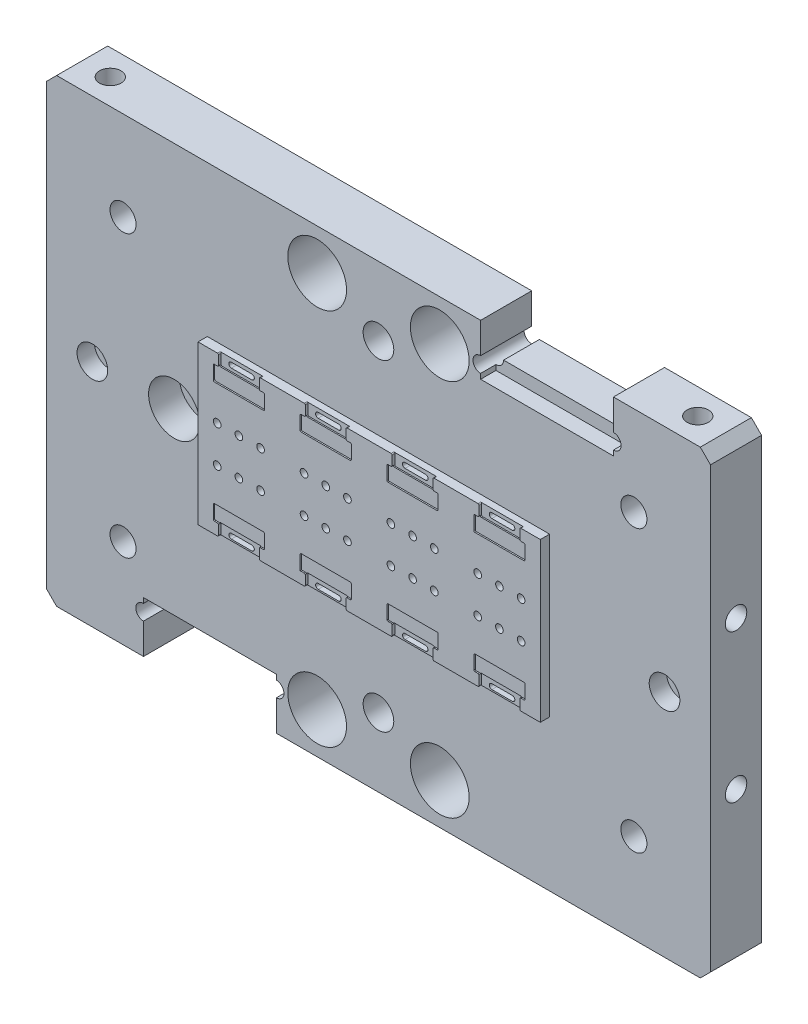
SolidWorks part; units mm, degrees
ref_plane "前视基准面" through (0, 0, 0) normal (0, 0, 1) x (1, 0, 0)
ref_plane "上视基准面" through (0, 0, 0) normal (0, 1, 0) x (1, 0, 0)
ref_plane "右视基准面" through (0, 0, 0) normal (1, 0, 0) x (0, 0, -1)
sketch "草图1" plane through (0, 0, 0) normal (0, 0, 1) x (1, 0, 0)
  line L1 (-65, 45) -> (65, 45)
  line L2 (-65, 45) -> (-65, -45)
  line L3 (-65, -45) -> (65, -45)
  line L4 (65, 45) -> (65, -45)
  line L5 (-65, 45) -> (65, -45) construction
  line L6 (-65, -45) -> (65, 45) construction
  point P0 (0, 0)
  dimension "D1" = 90
  dimension "D2" = 130
extrude "凸台-拉伸1" add sketch "草图1" along normal blind 10
chamfer "倒角1" distance 2 angle 45 4 edges at (-65, -45, 5) (65, -45, 5) (65, 45, 5) (-65, 45, 5)
hole_wizard "M3 六角圆柱头螺钉的柱形沉头孔1" positions "草图6" profile "草图7" counterbore size "M3" standard "GB"
sketch "草图6" plane through (0, 0, 10) normal (0, 0, 1) x (1, 0, 0)
  line L0 (0, 0) -> (-65, 0) construction
  line L1 (-65, 43) -> (-65, -43) construction
  line L4 (0, 0) -> (0, -45) construction
  line L5 (-63, -45) -> (63, -45) construction
  point P0 (-56, 0)
  point P2 (0, -31.5)
  point P24 (56, 0)
  point P25 (0, 31.5)
  dimension "D1" = 9
  dimension "D2" = 13.5
sketch "草图7" plane through (-56, 0, 10) normal (1, 0, 0) x (0, -1, 0)
  line L0 (0, 0) -> (0, 10)
  line L1 (0, 10) -> (1.7, 10)
  line L3 (1.7, 10) -> (1.7, 3.4)
  line L4 (1.7, 3.4) -> (3, 3.4)
  line L5 (3, 3.4) -> (3, 0)
  line L7 (3, 0) -> (0, 0)
  line L11 (0, -6.35) -> (0, 107.95) construction
  dimension "通孔孔直径" = 3.4
  dimension "通孔孔深度" = 10
  dimension "柱形沉头孔直径" = 6
  dimension "柱形沉头孔深度" = 3.4
sketch "草图8" plane through (0, 0, 0) normal (0, 0, -1) x (-1, 0, 0)
  circle A0 centre (-56, 0) radius 3
  circle A1 centre (0, 31.5) radius 3
  circle A2 centre (56, 0) radius 3
  circle A3 centre (0, -31.5) radius 3
  dimension "D1" = 6
extrude "切除-拉伸3" cut sketch "草图8" against normal blind 1
sketch "草图11" plane through (0, 0, 10) normal (0, 0, 1) x (1, 0, 0)
  line L0 (0, 0) -> (-65, 0) construction
  line L1 (-65, 43) -> (-65, -43) construction
  circle A0 centre (-40, 0) radius 3.25
  dimension "D1" = 6.5
  dimension "D2" = 40
extrude "切除-拉伸4" cut sketch "草图11" against normal through all
hole_wizard "M5 螺纹孔1" positions "草图17" profile "草图19" tap size "M5" standard "ISO"
sketch "草图17" plane through (0, -45, 0) normal (0, -1, 0) x (-1, 0, 0)
  line L0 (65, 0) -> (65, -10) construction
  line L1 (63, 0) -> (-63, 0) construction
  line L2 (0, 0) -> (0, -10) construction
  line L3 (63, -10) -> (-63, -10) construction
  point P0 (57.4989, -5)
  point P16 (-57.4989, -5)
  dimension "D1" = 7.5011
  dimension "D2" = 5
sketch "草图19" plane through (-57.4989, -45, 5) normal (1, 0, 0) x (0, 0, -1)
  line L0 (0, 0) -> (0, 7.2618)
  line L1 (0, 7.2618) -> (2.1, 6)
  line L2 (2.1, 6) -> (2.1, 0)
  line L5 (2.1, 0) -> (0, 0)
  line L10 (0, 7.2618) -> (-2.1, 6) construction
  line L11 (0, -6.35) -> (0, 107.95) construction
  dimension "螺纹孔钻头直径" = 4.2
  dimension "螺纹孔钻头深度" = 6
  dimension "导头角度" = 118
mirror "镜向1" about plane through (0, 0, 0) normal (0, 1, 0) of "M5 螺纹孔1"
sketch "草图22" plane through (0, 0, 0) normal (0, 0, -1) x (-1, 0, 0)
  circle A0 centre (40, 0) radius 5
  dimension "D1" = 10
extrude "切除-拉伸8" cut sketch "草图22" against normal blind 1
sketch "草图23" plane through (0, 0, 10) normal (0, 0, 1) x (1, 0, 0)
  circle A0 centre (-40, 0) radius 5
  dimension "D1" = 10
extrude "切除-拉伸9" cut sketch "草图23" against normal blind 6
sketch "草图24" plane through (0, 0, 10) normal (0, 0, 1) x (1, 0, 0)
  line L0 (63, 45) -> (-63, 45) construction
  line L1 (46, 45) -> (20, 45)
  line L2 (46, 45) -> (46, 37.5)
  line L3 (46, 37.5) -> (20, 37.5)
  line L4 (20, 45) -> (20, 37.5)
  line L6 (0, 0) -> (-65, 0) construction
  line L7 (-65, 43) -> (-65, -43) construction
  line L12 (-63, -45) -> (63, -45) construction
  line L13 (-46, -45) -> (-20, -45)
  line L14 (-46, -45) -> (-46, -37.5)
  line L15 (-46, -37.5) -> (-20, -37.5)
  line L16 (-20, -45) -> (-20, -37.5)
  dimension "D1" = 26
  dimension "D2" = 7.5
  dimension "D3" = 20
  dimension "D4" = 7.5
  dimension "D5" = 26
  dimension "D6" = 20
extrude "切除-拉伸10" cut sketch "草图24" against normal through all
sketch "草图25" plane through (0, 0, 6.6) normal (0, 0, 1) x (1, 0, 0)
  circle A0 centre (0, 31.5) radius 1.7 construction
  circle A1 centre (0, 31.5) radius 3
  circle A2 centre (0, 31.5) radius 3
  circle A3 centre (0, 31.5) radius 1.7
  circle A4 centre (0, -31.5) radius 1.7 construction
  circle A5 centre (0, -31.5) radius 3
  circle A6 centre (0, -31.5) radius 3
  circle A7 centre (0, -31.5) radius 1.7
  dimension "D1" = 0
  dimension "D2" = 0
extrude "切除-拉伸11" cut sketch "草图25" against normal blind 3
sketch "草图26" plane through (0, 0, 10) normal (0, 0, 1) x (1, 0, 0)
  line L0 (20, 45) -> (20, 37.5) construction
  line L1 (46, 37.5) -> (20, 37.5)
  line L2 (46, 37.5) -> (46, 35)
  line L3 (46, 35) -> (20, 35)
  line L4 (20, 37.5) -> (20, 35)
  line L5 (0, 0) -> (-65, 0) construction
  line L6 (-65, 43) -> (-65, -43) construction
  line L7 (-20, -35) -> (-46, -35)
  line L8 (-46, -35) -> (-46, -37.5)
  line L9 (-20, -35) -> (-20, -37.5)
  line L10 (-20, -37.5) -> (-46, -37.5)
  line L11 (-46, -37.5) -> (-46, -45) construction
  line L12 (-20, -45) -> (-20, -37.5) construction
  dimension "D1" = 2.5
  dimension "D2" = 2.5
extrude "切除-拉伸12" cut sketch "草图26" against normal blind 3
sketch "草图27" plane through (0, 0, 10) normal (0, 0, 1) x (1, 0, 0)
  line L1 (-33.5, 15.5) -> (33.5, 15.5)
  line L2 (-33.5, 15.5) -> (-33.5, -15.5)
  line L3 (-33.5, -15.5) -> (33.5, -15.5)
  line L4 (33.5, 15.5) -> (33.5, -15.5)
  line L5 (-33.5, 15.5) -> (33.5, -15.5) construction
  line L6 (-33.5, -15.5) -> (33.5, 15.5) construction
  point P0 (0, 0)
  dimension "D1" = 67
  dimension "D2" = 31
extrude "凸台-拉伸5" add sketch "草图27" along normal blind 1.82
hole_wizard "Ø1.5 (1.5) 直径孔1" positions "草图29" profile "草图30" hole size "Ø1.5" standard "GB"
sketch "草图29" plane through (0, 0, 11.82) normal (0, 0, 1) x (1, 0, 0)
  line L0 (0, 0) -> (0, -10.3369) construction
  line L3 (0, 0) -> (-17.2521, 0) construction
  point P0 (-4.25, -3.595)
  point P2 (-8.5, -3.595)
  point P4 (-12.75, -3.595)
  point P16 (-21.25, -3.595)
  point P17 (-25.5, -3.595)
  point P18 (-29.75, -3.595)
  point P23 (29.75, -3.595)
  point P24 (25.5, -3.595)
  point P25 (21.25, -3.595)
  point P26 (12.75, -3.595)
  point P27 (8.5, -3.595)
  point P28 (4.25, -3.595)
  point P36 (4.25, 3.595)
  point P37 (8.5, 3.595)
  point P38 (12.75, 3.595)
  point P39 (21.25, 3.595)
  point P40 (25.5, 3.595)
  point P41 (29.75, 3.595)
  point P42 (-29.75, 3.595)
  point P43 (-25.5, 3.595)
  point P44 (-21.25, 3.595)
  point P45 (-12.75, 3.595)
  point P46 (-8.5, 3.595)
  point P47 (-4.25, 3.595)
  dimension "D1" = 8.5
  dimension "D2" = 4.25
  dimension "D3" = 4.25
  dimension "D5" = 7.19
  dimension "D4" = 2
sketch "草图30" plane through (-4.25, -3.595, 11.82) normal (1, 0, 0) x (0, -1, 0)
  line L0 (0, 0) -> (0, 11.82)
  line L1 (0, 11.82) -> (0.75, 11.82)
  line L2 (0.75, 11.82) -> (0.75, 0)
  line L5 (0.75, 0) -> (0, 0)
  line L11 (0, -6.35) -> (0, 107.95) construction
  dimension "通孔孔直径" = 1.5
  dimension "通孔孔深度" = 11.82
sketch "草图31" plane through (0, 0, 11.82) normal (0, 0, 1) x (1, 0, 0)
  line L0 (-25.5, -3.595) -> (-25.5, -15.5) construction
  line L1 (-33.5, -15.5) -> (33.5, -15.5) construction
  line L2 (-12.5, -13.2) -> (-4.5, -13.2)
  line L3 (-29.5, -13.2) -> (-21.5, -13.2)
  line L4 (-29.5, -13.2) -> (-29.5, -15.5)
  line L5 (-29.5, -15.5) -> (-21.5, -15.5)
  line L6 (-21.5, -13.2) -> (-21.5, -15.5)
  line L7 (-29.5, -13.2) -> (-21.5, -15.5) construction
  line L8 (-29.5, -15.5) -> (-21.5, -13.2) construction
  line L9 (-12.5, -13.2) -> (-12.5, -15.5)
  line L10 (-12.5, -15.5) -> (-4.5, -15.5)
  line L11 (-4.5, -13.2) -> (-4.5, -15.5)
  line L12 (4.5, -13.2) -> (12.5, -13.2)
  line L13 (4.5, -13.2) -> (4.5, -15.5)
  line L14 (4.5, -15.5) -> (12.5, -15.5)
  line L15 (12.5, -13.2) -> (12.5, -15.5)
  line L16 (21.5, -13.2) -> (29.5, -13.2)
  line L17 (21.5, -13.2) -> (21.5, -15.5)
  line L18 (21.5, -15.5) -> (29.5, -15.5)
  line L19 (29.5, -13.2) -> (29.5, -15.5)
  line L20 (0, 0) -> (-21.5, 0) construction
  line L21 (-29.5, 15.5) -> (-21.5, 13.2) construction
  line L22 (-29.5, 13.2) -> (-21.5, 15.5) construction
  line L23 (29.5, 13.2) -> (29.5, 15.5)
  line L24 (21.5, 15.5) -> (29.5, 15.5)
  line L25 (21.5, 13.2) -> (21.5, 15.5)
  line L26 (21.5, 13.2) -> (29.5, 13.2)
  line L27 (12.5, 13.2) -> (12.5, 15.5)
  line L28 (4.5, 15.5) -> (12.5, 15.5)
  line L29 (4.5, 13.2) -> (4.5, 15.5)
  line L30 (4.5, 13.2) -> (12.5, 13.2)
  line L31 (-4.5, 13.2) -> (-4.5, 15.5)
  line L32 (-12.5, 15.5) -> (-4.5, 15.5)
  line L33 (-12.5, 13.2) -> (-12.5, 15.5)
  line L34 (-21.5, 13.2) -> (-21.5, 15.5)
  line L35 (-29.5, 15.5) -> (-21.5, 15.5)
  line L36 (-29.5, 13.2) -> (-29.5, 15.5)
  line L37 (-29.5, 13.2) -> (-21.5, 13.2)
  line L38 (-12.5, 13.2) -> (-4.5, 13.2)
  point P5 (-25.5, -14.35)
  point P41 (-25.5, 14.35)
  dimension "D1" = 2.3
  dimension "D2" = 8
  dimension "D3" = 4
extrude "切除-拉伸14" cut sketch "草图31" against normal blind 0.52
sketch "草图32" plane through (0, 0, 11.82) normal (0, 0, 1) x (1, 0, 0)
  line L0 (-25.5, -3.595) -> (-25.5, -15.5) construction
  line L1 (-29.5, -15.5) -> (-21.5, -15.5) construction
  line L2 (-21.5, -13.2) -> (-29.5, -13.2) construction
  line L3 (-30.5, -10.3) -> (-20.5, -10.3)
  line L4 (-30.5, -10.3) -> (-30.5, -13.3)
  line L5 (-30.5, -13.3) -> (-20.5, -13.3)
  line L6 (-20.5, -10.3) -> (-20.5, -13.3)
  line L7 (-30.5, -10.3) -> (-20.5, -13.3) construction
  line L8 (-30.5, -13.3) -> (-20.5, -10.3) construction
  line L9 (-13.5, -10.3) -> (-3.5, -10.3)
  line L10 (-13.5, -10.3) -> (-13.5, -13.3)
  line L11 (-13.5, -13.3) -> (-3.5, -13.3)
  line L12 (-3.5, -10.3) -> (-3.5, -13.3)
  line L13 (-13.5, -10.3) -> (-3.5, -13.3) construction
  line L14 (-13.5, -13.3) -> (-3.5, -10.3) construction
  line L15 (3.5, -10.3) -> (13.5, -10.3)
  line L16 (3.5, -10.3) -> (3.5, -13.3)
  line L17 (3.5, -13.3) -> (13.5, -13.3)
  line L18 (13.5, -10.3) -> (13.5, -13.3)
  line L19 (3.5, -10.3) -> (13.5, -13.3) construction
  line L20 (3.5, -13.3) -> (13.5, -10.3) construction
  line L21 (20.5, -10.3) -> (30.5, -10.3)
  line L22 (20.5, -10.3) -> (20.5, -13.3)
  line L23 (20.5, -13.3) -> (30.5, -13.3)
  line L24 (30.5, -10.3) -> (30.5, -13.3)
  line L25 (20.5, -10.3) -> (30.5, -13.3) construction
  line L26 (20.5, -13.3) -> (30.5, -10.3) construction
  line L27 (0, 0) -> (-13.5, 0) construction
  line L28 (20.5, 13.3) -> (30.5, 10.3) construction
  line L29 (20.5, 10.3) -> (30.5, 13.3) construction
  line L30 (3.5, 13.3) -> (13.5, 10.3) construction
  line L31 (3.5, 10.3) -> (13.5, 13.3) construction
  line L32 (-13.5, 13.3) -> (-3.5, 10.3) construction
  line L33 (-13.5, 10.3) -> (-3.5, 13.3) construction
  line L34 (-30.5, 13.3) -> (-20.5, 10.3) construction
  line L35 (-30.5, 10.3) -> (-20.5, 13.3) construction
  line L36 (30.5, 10.3) -> (30.5, 13.3)
  line L37 (20.5, 13.3) -> (30.5, 13.3)
  line L38 (20.5, 10.3) -> (20.5, 13.3)
  line L39 (20.5, 10.3) -> (30.5, 10.3)
  line L40 (13.5, 10.3) -> (13.5, 13.3)
  line L41 (3.5, 13.3) -> (13.5, 13.3)
  line L42 (3.5, 10.3) -> (3.5, 13.3)
  line L43 (3.5, 10.3) -> (13.5, 10.3)
  line L44 (-3.5, 10.3) -> (-3.5, 13.3)
  line L45 (-13.5, 13.3) -> (-3.5, 13.3)
  line L46 (-13.5, 10.3) -> (-13.5, 13.3)
  line L47 (-13.5, 10.3) -> (-3.5, 10.3)
  line L48 (-20.5, 10.3) -> (-20.5, 13.3)
  line L49 (-30.5, 13.3) -> (-20.5, 13.3)
  line L50 (-30.5, 10.3) -> (-30.5, 13.3)
  line L51 (-30.5, 10.3) -> (-20.5, 10.3)
  point P5 (-25.5, -11.8)
  point P10 (-8.5, -11.8)
  point P18 (8.5, -11.8)
  point P23 (25.5, -11.8)
  point P46 (25.5, 11.8)
  point P47 (8.5, 11.8)
  point P48 (-8.5, 11.8)
  point P49 (-25.5, 11.8)
  dimension "D1" = 3
  dimension "D2" = 0.1
  dimension "D3" = 10
  dimension "D4" = 4
extrude "切除-拉伸15" cut sketch "草图32" against normal blind 0.27
fillet "圆角4" radius 0.2 62 edges at (20.5, 13.3, 11.685) (20.5, 10.3, 11.685) (30.5, 13.3, 11.685) (30.5, 10.3, 11.685) (29.5, 13.2, 11.425) (21.5, 13.2, 11.425) (21.5, 15.5, 11.56) (29.5, 15.5, 11.56) (4.5, 15.5, 11.56) (12.5, 15.5, 11.56) (12.5, 13.2, 11.425) (4.5, 13.2, 11.425) (3.5, 13.3, 11.685) (13.5, 13.3, 11.685) (13.5, 10.3, 11.685) (3.5, 10.3, 11.685) (-12.5, 15.5, 11.56) (-4.5, 15.5, 11.56) (-12.5, 13.2, 11.425) (-4.5, 13.2, 11.425) (-3.5, 13.3, 11.685) (-3.5, 10.3, 11.685) (-13.5, 13.3, 11.685) (-13.5, 10.3, 11.685) (-20.5, 13.3, 11.685) (-20.5, 10.3, 11.685) (-30.5, 10.3, 11.685) (-30.5, 13.3, 11.685) (-29.5, 13.2, 11.425) (-21.5, 13.2, 11.425) (-29.5, 15.5, 11.56) (-21.5, 15.5, 11.56) (21.5, -15.5, 11.56) (29.5, -15.5, 11.56) (29.5, -13.2, 11.425) (30.5, -13.3, 11.685) (30.5, -10.3, 11.685) (20.5, -10.3, 11.685) (20.5, -13.3, 11.685) (12.5, -15.5, 11.56) (4.5, -15.5, 11.56) (4.5, -13.2, 11.425) (12.5, -13.2, 11.425) (13.5, -13.3, 11.685) (13.5, -10.3, 11.685) (3.5, -10.3, 11.685) (3.5, -13.3, 11.685) (-4.5, -15.5, 11.56) (-12.5, -15.5, 11.56) (-12.5, -13.2, 11.425) (-4.5, -13.2, 11.425) (-3.5, -13.3, 11.685) (-3.5, -10.3, 11.685) (-13.5, -10.3, 11.685) (-21.5, -15.5, 11.56) (-29.5, -15.5, 11.56) (-29.5, -13.2, 11.425) (-30.5, -13.3, 11.685) (-30.5, -10.3, 11.685) (-20.5, -10.3, 11.685) (-20.5, -13.3, 11.685) (-21.5, -13.2, 11.425)
fillet "圆角5" radius 0.2 16 edges at (-21.5268, -13.3, 11.685) (-29.4732, -13.3, 11.685) (-12.4732, -13.3, 11.685) (-4.5268, -13.3, 11.685) (4.5268, -13.3, 11.685) (12.4732, -13.3, 11.685) (21.5, -13.3, 11.685) (29.4732, -13.3, 11.685) (-29.4732, 13.3, 11.685) (-21.5268, 13.3, 11.685) (-12.4732, 13.3, 11.685) (-4.5268, 13.3, 11.685) (4.5268, 13.3, 11.685) (12.4732, 13.3, 11.685) (21.5268, 13.3, 11.685) (29.4732, 13.3, 11.685)
sketch "草图34" plane through (0, 0, 11.3) normal (0, 0, 1) x (1, 0, 0)
  line L0 (-25.5, -10.3) -> (-25.5, -17.2063) construction
  line L1 (-20.7, -10.3) -> (-30.3, -10.3) construction
  line L2 (-27.5, -14.7) -> (-23.5, -14.7) construction
  line L3 (-27.5, -14.2) -> (-23.5, -14.2)
  line L4 (-27.5, -15.2) -> (-23.5, -15.2)
  line L5 (-29.3, -13.2) -> (-21.7, -13.2) construction
  line L6 (-10.5, -14.7) -> (-6.5, -14.7) construction
  line L7 (-10.5, -14.2) -> (-6.5, -14.2)
  line L8 (-10.5, -15.2) -> (-6.5, -15.2)
  line L9 (6.5, -14.7) -> (10.5, -14.7) construction
  line L10 (6.5, -14.2) -> (10.5, -14.2)
  line L11 (6.5, -15.2) -> (10.5, -15.2)
  line L12 (23.5, -14.7) -> (27.5, -14.7) construction
  line L13 (23.5, -14.2) -> (27.5, -14.2)
  line L14 (23.5, -15.2) -> (27.5, -15.2)
  line L15 (-10.5, 14.3) -> (-6.5, 14.3) construction
  line L16 (-10.5, 14.8) -> (-6.5, 14.8)
  line L17 (-10.5, 13.8) -> (-6.5, 13.8)
  line L18 (6.5, 14.3) -> (10.5, 14.3) construction
  line L19 (6.5, 14.8) -> (10.5, 14.8)
  line L20 (6.5, 13.8) -> (10.5, 13.8)
  line L21 (23.5, 14.3) -> (27.5, 14.3) construction
  line L22 (23.5, 14.8) -> (27.5, 14.8)
  line L23 (23.5, 13.8) -> (27.5, 13.8)
  line L24 (-27.5, 14.3) -> (-23.5, 14.3) construction
  line L25 (-27.5, 14.8) -> (-23.5, 14.8)
  line L26 (-27.5, 13.8) -> (-23.5, 13.8)
  arc A0 (-27.5, -14.2) -> (-27.5, -15.2) centre (-27.5, -14.7) ccw
  arc A1 (-23.5, -15.2) -> (-23.5, -14.2) centre (-23.5, -14.7) ccw
  arc A2 (-10.5, -14.2) -> (-10.5, -15.2) centre (-10.5, -14.7) ccw
  arc A3 (-6.5, -15.2) -> (-6.5, -14.2) centre (-6.5, -14.7) ccw
  arc A4 (6.5, -14.2) -> (6.5, -15.2) centre (6.5, -14.7) ccw
  arc A5 (10.5, -15.2) -> (10.5, -14.2) centre (10.5, -14.7) ccw
  arc A6 (23.5, -14.2) -> (23.5, -15.2) centre (23.5, -14.7) ccw
  arc A7 (27.5, -15.2) -> (27.5, -14.2) centre (27.5, -14.7) ccw
  arc A8 (-10.5, 14.8) -> (-10.5, 13.8) centre (-10.5, 14.3) ccw
  arc A9 (-6.5, 13.8) -> (-6.5, 14.8) centre (-6.5, 14.3) ccw
  arc A10 (6.5, 14.8) -> (6.5, 13.8) centre (6.5, 14.3) ccw
  arc A11 (10.5, 13.8) -> (10.5, 14.8) centre (10.5, 14.3) ccw
  arc A12 (23.5, 14.8) -> (23.5, 13.8) centre (23.5, 14.3) ccw
  arc A13 (27.5, 13.8) -> (27.5, 14.8) centre (27.5, 14.3) ccw
  arc A14 (-27.5, 14.8) -> (-27.5, 13.8) centre (-27.5, 14.3) ccw
  arc A15 (-23.5, 13.8) -> (-23.5, 14.8) centre (-23.5, 14.3) ccw
  point P6 (-25.5, -14.7)
  point P11 (-23, -14.7)
  point P18 (-8.5, -14.7)
  point P25 (8.5, -14.7)
  point P32 (25.5, -14.7)
  point P39 (-8.5, 14.3)
  point P46 (8.5, 14.3)
  point P53 (25.5, 14.3)
  point P60 (-25.5, 14.3)
  dimension "D2" = 0.5
  dimension "D1" = 4
  dimension "D3" = 1.5
  dimension "D5" = 4
  dimension "D4" = 2
extrude "切除-拉伸17" cut sketch "草图34" against normal blind 6
hole_wizard "M5 螺纹孔2" positions "草图36" profile "草图38" tap size "M5" standard "GB"
sketch "草图36" plane through (-65, 0, 0) normal (-1, 0, 0) x (0, 0, 1)
  line L0 (0, 0) -> (15.9483, 0) construction
  line L3 (10, 43) -> (10, -43) construction
  point P0 (5, 14.5)
  point P10 (5, -14.5)
  dimension "D1" = 29
  dimension "D2" = 5
sketch "草图38" plane through (-65, 14.5, 5) normal (0, 1, 0) x (0, 0, 1)
  line L0 (0, 0) -> (0, 66.2618)
  line L1 (0, 66.2618) -> (2.1, 65)
  line L2 (2.1, 65) -> (2.1, 0)
  line L5 (2.1, 0) -> (0, 0)
  line L10 (0, 66.2618) -> (-2.1, 65) construction
  line L11 (0, -6.35) -> (0, 107.95) construction
  dimension "螺纹孔钻头直径" = 4.2
  dimension "螺纹孔钻头深度" = 65
  dimension "导头角度" = 118
mirror "镜向2" about plane through (0, 0, 0) normal (1, 0, 0) of "M5 螺纹孔2"
hole_wizard "Ø5.1 (5.1) 直径孔1" positions "草图39" profile "草图40" hole size "Ø5.1" standard "GB"
sketch "草图39" plane through (0, 0, 10) normal (0, 0, 1) x (1, 0, 0)
  line L0 (0, 0) -> (-49.9946, 0) construction
  line L3 (0, 0) -> (0, 26.6447) construction
  point P0 (-50, 27.5)
  point P16 (50, 27.5)
  point P17 (50, -27.5)
  point P18 (-50, -27.5)
  dimension "D1" = 100
  dimension "D2" = 55
sketch "草图40" plane through (-50, 27.5, 10) normal (1, 0, 0) x (0, -1, 0)
  line L0 (0, 0) -> (0, 66.5322)
  line L1 (0, 66.5322) -> (2.55, 65)
  line L2 (2.55, 65) -> (2.55, 0)
  line L5 (2.55, 0) -> (0, 0)
  line L10 (0, 66.5322) -> (-2.55, 65) construction
  line L11 (0, -6.35) -> (0, 107.95) construction
  dimension "孔直径" = 5.1
  dimension "孔深度" = 65
  dimension "导头角度" = 118
sketch "草图41" plane through (0, 0, 0) normal (0, 0, -1) x (-1, 0, 0)
  circle A0 centre (-46, 37.5) radius 1.5
  circle A1 centre (-20, 37.5) radius 1.5
  circle A2 centre (20, -37.5) radius 1.5
  circle A3 centre (46, -37.5) radius 1.5
  dimension "D1" = 3
extrude "切除-拉伸18" cut sketch "草图41" against normal through all
sketch "草图43" plane through (0, 0, 10) normal (0, 0, 1) x (1, 0, 0)
  line L0 (0, 0) -> (0, 41.1605) construction
  line L1 (0, 0) -> (-65, 0) construction
  line L2 (-65, 43) -> (-65, -43) construction
  circle A0 centre (-12, 37) radius 5.75
  circle A1 centre (12, 37) radius 5.75
  circle A2 centre (12, -37) radius 5.75
  circle A3 centre (-12, -37) radius 5.75
  dimension "D1" = 11.5
  dimension "D2" = 24
  dimension "D3" = 74
extrude "切除-拉伸19" cut sketch "草图43" against normal through all
